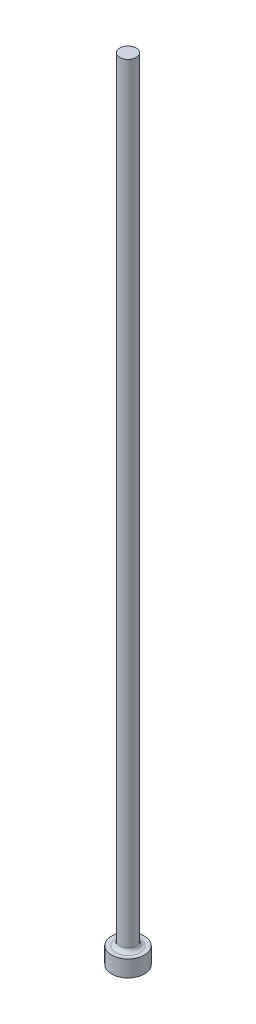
SolidWorks part; units mm, degrees
ref_plane "Front Plane" through (0, 0, 0) normal (0, 0, 1) x (1, 0, 0)
ref_plane "Top Plane" through (0, 0, 0) normal (0, 1, 0) x (1, 0, 0)
ref_plane "Right Plane" through (0, 0, 0) normal (1, 0, 0) x (0, 0, -1)
sketch "Sketch1" plane through (0, 0, 0) normal (0, 0, 1) x (1, 0, 0)
  line L0 (0, 0) -> (3.175, 0)
  line L1 (55, 0) -> (-55, 0) construction
  line L2 (3.175, 0) -> (3.175, 3.175)
  line L3 (3.175, 3.175) -> (2.3495, 3.175)
  line L4 (1.5875, 3.937) -> (1.5875, 152.4)
  line L5 (1.5875, 152.4) -> (0, 152.4)
  line L6 (0, 152.4) -> (0, 0)
  arc A0 (2.3495, 3.175) -> (1.5875, 3.937) centre (2.3495, 3.937) cw
  dimension "D5" = 0.762
  dimension "D1" = 1.5875
  dimension "D2" = 3.175
  dimension "D3" = 3.175
  dimension "D4" = 152.4
revolve "Revolve1" add sketch "Sketch1" angle 360 about L6
